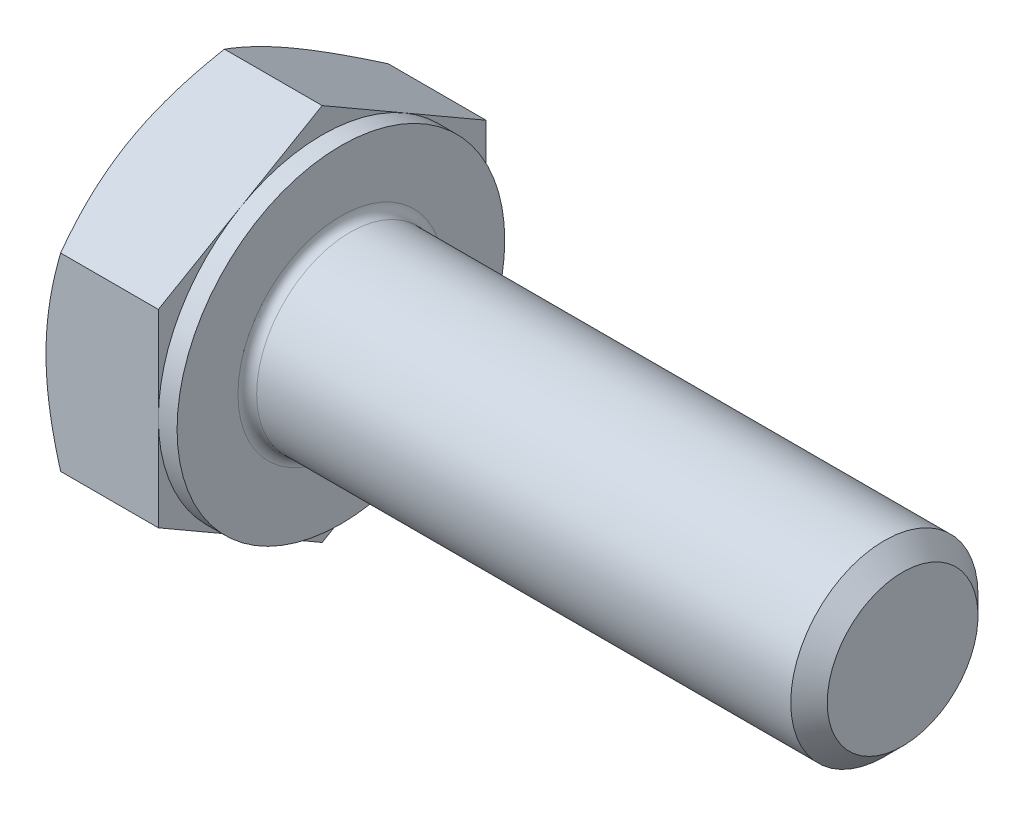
SolidWorks part; units mm, degrees
ref_plane "Plane1" through (0, 0, 0) normal (0, 0, 1) x (1, 0, 0)
ref_plane "Plane2" through (0, 0, 0) normal (0, 1, 0) x (1, 0, 0)
ref_plane "Plane3" through (0, 0, 0) normal (1, 0, 0) x (0, 0, -1)
sketch "Sketch1" plane through (0, 0, 0) normal (1, 0, 0) x (0, 0, -1)
  line L0 (3.5, 2.0207) -> (3.5, -2.0207)
  line L1 (-3.5, 2.0207) -> (-3.5, -2.0207)
  line L2 (3.5, -2.0207) -> (0, -4.0415)
  line L3 (0, -4.0415) -> (-3.5, -2.0207)
  line L4 (3.5, 2.0207) -> (0, 4.0415)
  line L5 (0, 4.0415) -> (-3.5, 2.0207)
  dimension "Width_flats" = 7
  dimension "D2" = 120
  dimension "D3" = 3.5
  dimension "D4" = 3.5
  dimension "D5" = 3.5
extrude "BaseHead" add sketch "Sketch1" along normal blind 2.8
sketch "BodySke" plane through (0, 0, 0) normal (0, 0, 1) x (1, 0, 0)
  line L0 (0, 2.0207) -> (0, -2.0207) construction
  line L1 (0, 0) -> (14.8, 0)
  line L2 (0, 0) -> (0, 2)
  line L3 (0, 2) -> (14.41, 2)
  line L4 (14.8, 0) -> (14.8, 1.61)
  line L5 (2.8, 4.0415) -> (2.8, 2.0207) construction
  line L6 (14.8, 1.61) -> (14.41, 2)
  line L7 (0, 0) -> (96.52, 0) construction
  line L8 (14.8, -1.61) -> (14.41, -2) construction
  line L9 (0, -2) -> (14.41, -2) construction
  line L10 (3.5, 15.24) -> (3.5, -1.27) construction
  line L11 (3.8, 15.24) -> (3.8, -1.27) construction
  line L12 (2.8, 2.0207) -> (2.8, -2.0207) construction
  dimension "Length" = 12
  dimension "Body_ch_ang" = 45
  dimension "Diameter" = 4
  dimension "Minor_dia" = 3.22
  dimension "Advance" = 0.7
  dimension "Thread_nom" = 11
revolve "BaseBody" add sketch "BodySke"
fillet "HeadFillet" radius 0.2 1 edges at (2.8, 0, -2)
sketch "Sketch3" plane through (0, 0, 0) normal (0, 0, 1) x (1, 0, 0)
  line L0 (0, 3.5) -> (3.1994, 9.0415)
  line L1 (0, 4.0415) -> (0, 2.0207) construction
  line L2 (3.1994, 9.0415) -> (3.1994, 14.0415)
  line L3 (3.1994, 14.0415) -> (-10, 14.0415)
  line L4 (-10, 14.0415) -> (-10, 3.5)
  line L5 (-10, 3.5) -> (0, 3.5)
  line L6 (0, 0) -> (99.06, 0) construction
  line L7 (2.8, 4.0415) -> (0, 4.0415) construction
  dimension "D1" = 3.5
  dimension "D2" = 5
  dimension "D3" = 10
  dimension "D4" = 5
  dimension "Head_ch_ang" = 30
revolve "HeadChamfer" cut sketch "Sketch3" angle 360 about L6
sketch "Sketch4" plane through (0, 0, 0) normal (0, 0, 1) x (1, 0, 0)
  line L1 (2.8, 4.0415) -> (2.8, 2.0207) construction
  line L2 (2.8, 3.5) -> (2.4, 3.5)
  line L3 (2.8, 3.5) -> (2.8, 14.0415)
  line L4 (2.8, 14.0415) -> (2.4, 14.0415)
  line L5 (0, 0) -> (95.25, 0) construction
  line L6 (0, 0) -> (96.52, 0) construction
  line L7 (2.4, 3.5) -> (2.4, 14.0415)
  line L8 (2.8, 4.0415) -> (0.3126, 4.0415) construction
  dimension "D1" = 7
  dimension "D2" = 10
  dimension "Bearing_ht" = 0.4
revolve "BearingFace" cut sketch "Sketch4" angle 360 about L5
sketch "ThdSchSke" plane through (0, 0, 0) normal (0, 0, 1) x (1, 0, 0)
  line L0 (3.8, -1.61) -> (3.5269, -2)
  line L1 (3.8, -1.61) -> (4.0731, -2)
  line L2 (4.0731, -2) -> (4.0731, -2.5)
  line L3 (-3.175, 0) -> (5.1513, 0) construction
  line L5 (4.0731, -2.5) -> (3.5269, -2.5)
  line L6 (3.5269, -2.5) -> (3.5269, -2)
  dimension "Thread_minor" = 3.22
  dimension "Diameter" = 4
  dimension "Start" = 3.8
  dimension "SideAngle" = 55
  dimension "VeeAngle" = 70
  dimension "Overcut" = 5
revolve "ThreadSchematic" [suppressed] cut sketch "ThdSchSke" angle 360 about L3
pattern_linear "ThdSchPat" [suppressed]
equation "\"D3@Sketch1\" = \"Width_flats@Sketch1\" / 2"
equation "\"D4@Sketch1\" = \"D3@Sketch1\""
equation "\"D5@Sketch1\" = \"D4@Sketch1\""
equation "\"Thread_minor@ThreadCosmetic\" = \"Minor_dia@BodySke\""
equation "\"D1@Sketch3\" = \"Width_flats@Sketch1\" / 2"
equation "\"D1@Sketch4\" = \"Width_flats@Sketch1\""
equation "\"Thread_length@ThreadCosmetic\" = ((sgn( (\"Length@BodySke\" - \"Advance@BodySke\" ) - \"Thread_nom@BodySke\" )-1)*( (\"Length@BodySke\" - \"Advance@BodySke\" ) - \"Thread_nom@BodySke\" ))/-2+ \"Thread_nom@BodySke\""
equation "\"Thread_minor@ThdSchSke\" = \"Minor_dia@BodySke\""
equation "\"Diameter@ThdSchSke\" = \"Diameter@BodySke\""
equation "\"Overcut@ThdSchSke\" = \"Diameter@BodySke\" * 1.25"
equation "\"Start@ThdSchSke\" = \"Head_ht@BaseHead\" + \"Length@BodySke\" - \"Thread_length@ThreadCosmetic\"  '---Non-countersunk---"
equation "\"Num_threads@ThdSchPat\" = int( \"Thread_length@ThreadCosmetic\" / \"Advance@BodySke\" + 0.999 )  + 1"
equation "\"Advance@ThdSchPat\" = \"Thread_length@ThreadCosmetic\" /  (\"Num_threads@ThdSchPat\" - 1) 'relax it"
equation "\"Num_threads@ThdSchPat\" = \"Num_threads@ThdSchPat\" - sgn( \"Num_threads@ThdSchPat\" - 1) '---chamfered tips only---"
